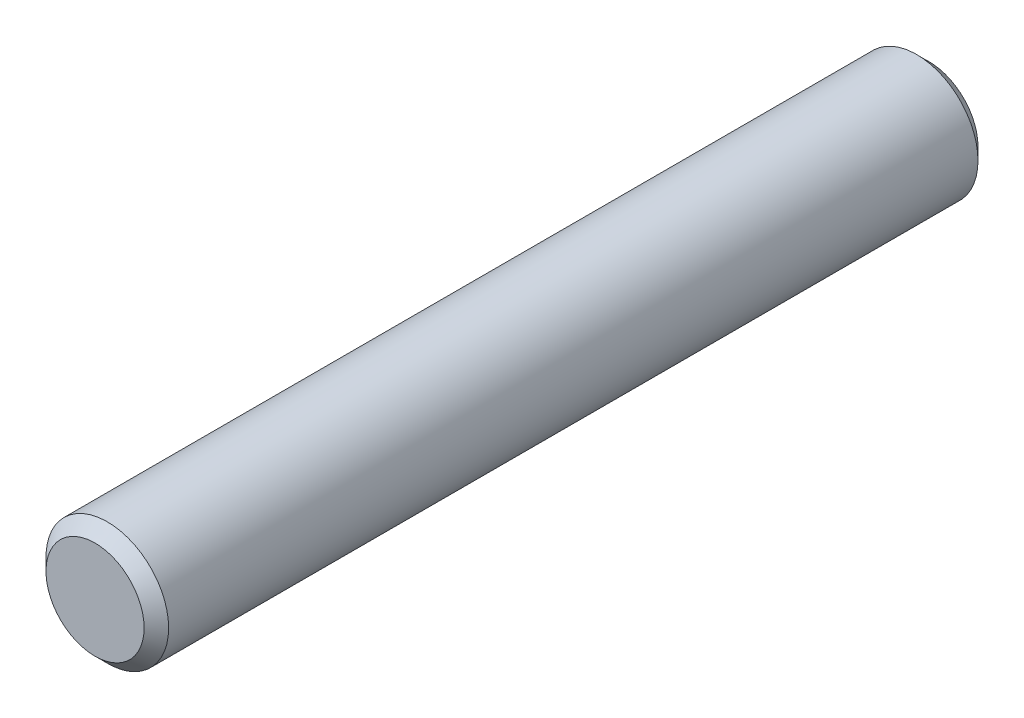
SolidWorks part; units mm, degrees
ref_plane "Piano frontale" through (0, 0, 0) normal (0, 0, 1) x (1, 0, 0)
ref_plane "Piano superiore" through (0, 0, 0) normal (0, 1, 0) x (1, 0, 0)
ref_plane "Piano destro" through (0, 0, 0) normal (1, 0, 0) x (0, 0, -1)
sketch "Schizzo1" plane through (0, 0, 0) normal (0, 0, 1) x (1, 0, 0)
  circle A0 centre (0, 0) radius 5
  dimension "D1" = 10
extrude "Estrusione-Estrusione1" add sketch "Schizzo1" along normal blind 68
chamfer "Smusso1" distance 1 angle 45 1 edges at (5, 0, 0)
chamfer "Smusso2" distance 1 angle 45 1 edges at (5, 0, 68)
